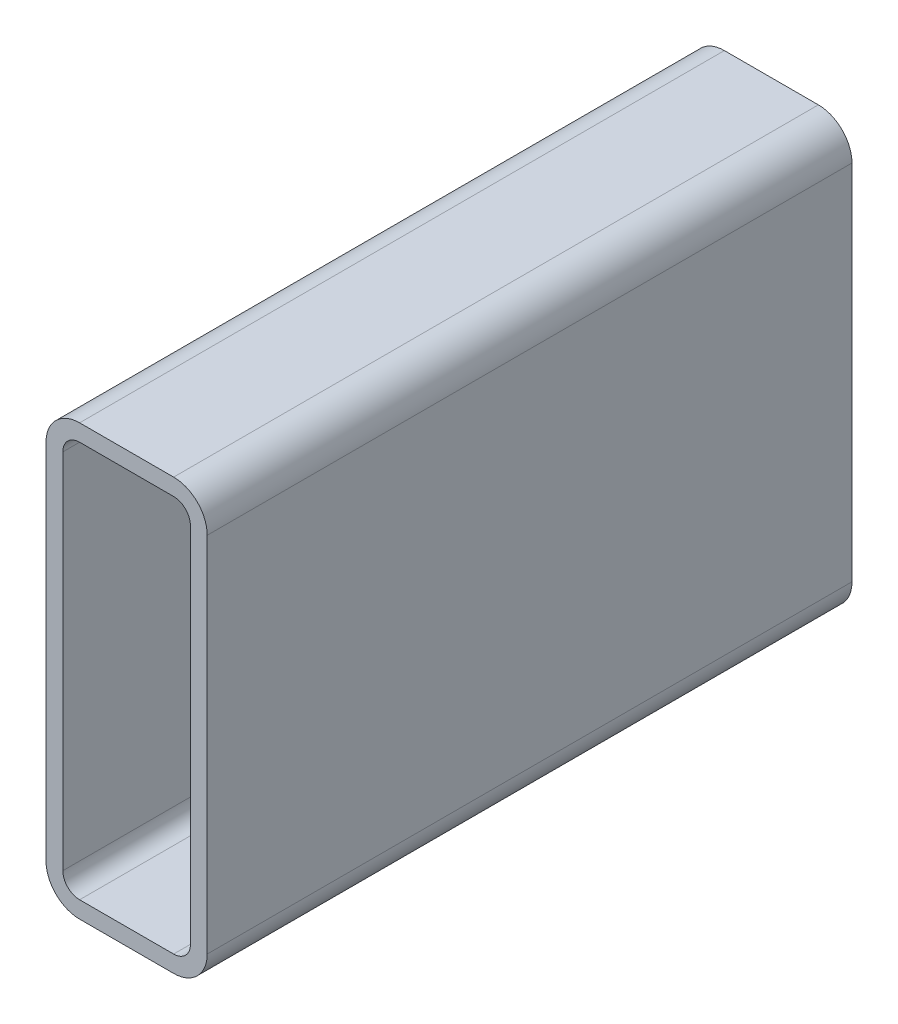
SolidWorks part; units mm, degrees
ref_plane "Front Plane" through (0, 0, 0) normal (0, 0, 1) x (1, 0, 0)
ref_plane "Top Plane" through (0, 0, 0) normal (0, 1, 0) x (1, 0, 0)
ref_plane "Right Plane" through (0, 0, 0) normal (1, 0, 0) x (0, 0, -1)
sketch "Sketch1" plane through (0, 0, 0) normal (0, 0, 1) x (1, 0, 0)
sketch_block_instance "HSS8x3x0.3125-1"
sketch_block "HSS8x3x0.3125"
extrude "Boss-Extrude1" add sketch "Sketch1" along normal blind 304.8
